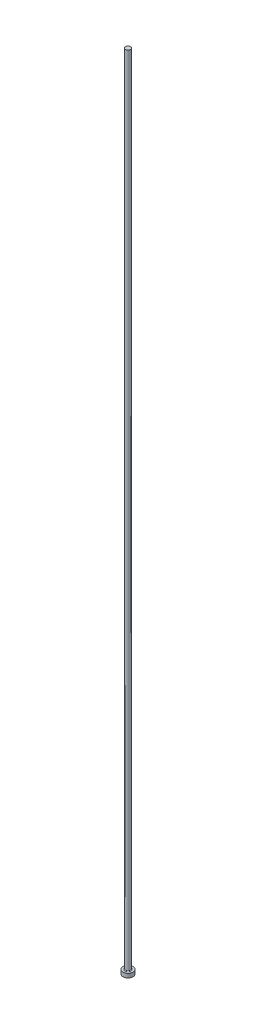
SolidWorks part; units mm, degrees
ref_plane "Plano frontal" through (0, 0, 0) normal (0, 0, 1) x (1, 0, 0)
ref_plane "Plano superior" through (0, 0, 0) normal (0, 1, 0) x (1, 0, 0)
ref_plane "Plano direito" through (0, 0, 0) normal (1, 0, 0) x (0, 0, -1)
sketch "Esboço1" plane through (0, 0, 0) normal (0, 0, 1) x (1, 0, 0)
  line L0 (0, 0) -> (2.5, 0)
  line L1 (2.5, 0) -> (2.5, 2)
  line L2 (2.5, 2) -> (1.55, 2)
  line L3 (1.25, 2.3) -> (1.25, 400)
  line L4 (1.25, 400) -> (0, 400)
  line L5 (0, 400) -> (0, 0) construction
  line L6 (0, 0) -> (0, 400)
  arc A0 (1.55, 2) -> (1.25, 2.3) centre (1.55, 2.3) cw
  dimension "D3" = 0.3
  dimension "D1" = 5
  dimension "D2" = 2.5
  dimension "D4" = 2
  dimension "D5" = 400
revolve "Revolução1" add sketch "Esboço1" angle 360 about L5
sketch "Esboço2"
  dimension "D1" = 0.2812
  dimension "D2" = 0.4375
  dimension "D3" = 0.1875
  dimension "D4" = 1.3438
wrap "Envolver1" sketch "Esboço2" wrap type deboss source sketch "Esboço2" thickness 0.1 parameters "D1"=0.1
